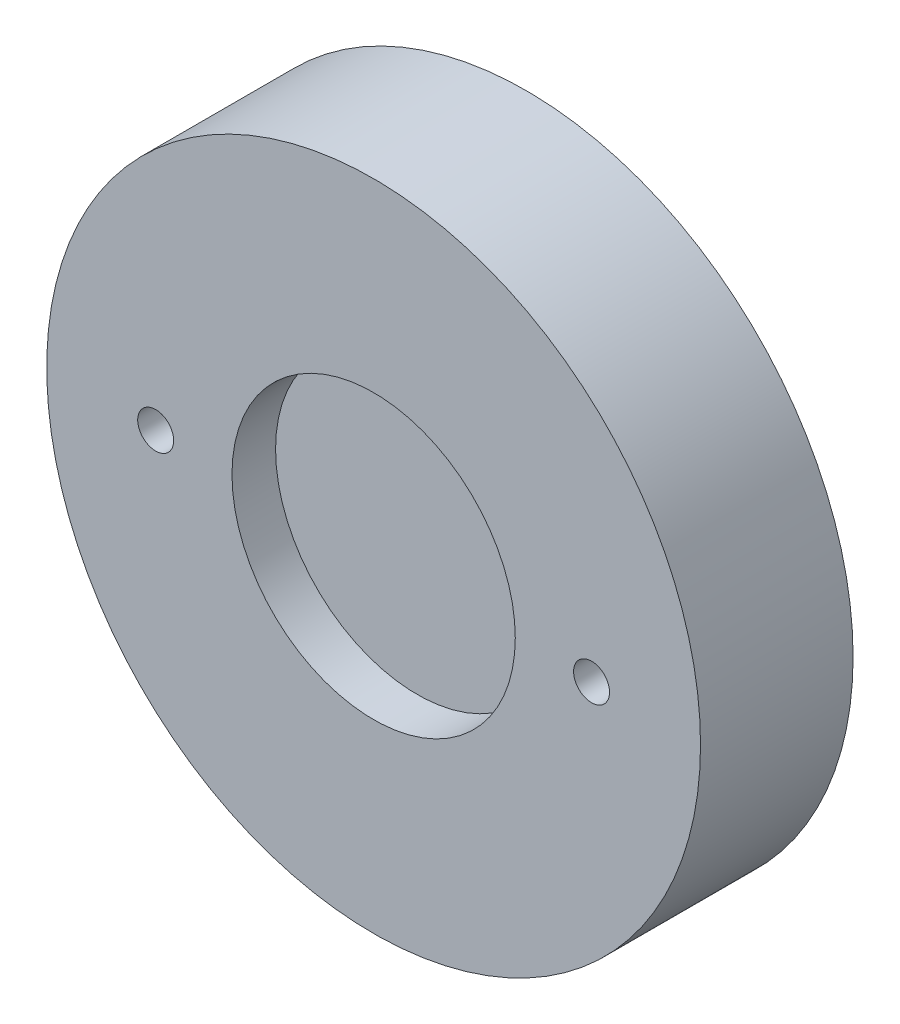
SolidWorks part; units mm, degrees
ref_plane "Plan de face" through (0, 0, 0) normal (0, 0, 1) x (1, 0, 0)
ref_plane "Plan de dessus" through (0, 0, 0) normal (0, 1, 0) x (1, 0, 0)
ref_plane "Plan de droite" through (0, 0, 0) normal (1, 0, 0) x (0, 0, -1)
sketch "Esquisse1" plane through (0, 0, 0) normal (0, 0, 1) x (1, 0, 0)
  circle A0 centre (0, 0) radius 60
extrude "Boss.-Extru.1" add sketch "Esquisse1" along normal blind 28
sketch "Esquisse2" plane through (0, 0, 28) normal (0, 0, 1) x (1, 0, 0)
  circle A0 centre (0, 0) radius 26
extrude "Enlèv. mat.-Extru.1" cut sketch "Esquisse2" against normal blind 8
sketch "Esquisse22" [suppressed] plane through (0, 0, 30) normal (0, 0, 1) x (1, 0, 0)
  line L0 (60, 0) -> (-60, 0) construction
  circle A0 centre (0, 0) radius 60 construction
  point P3 (40, 0)
  point P6 (-40, 0)
  dimension "D1" = 40
  dimension "D2" = 80
hole_wizard "Dégagement M62" positions "Esquisse26" profile "Esquisse25" hole size "M6" standard "ISO"
sketch "Esquisse26" plane through (0, 0, 28) normal (0, 0, 1) x (1, 0, 0)
  point P0 (-40, 0)
  point P1 (40, 0)
sketch "Esquisse25" plane through (-40, 0, 28) normal (1, 0, 0) x (0, -1, 0)
  line L0 (0, 0) -> (0, 28)
  line L1 (0, 28) -> (3.3, 28)
  line L2 (3.3, 28) -> (3.3, 0)
  line L5 (3.3, 0) -> (0, 0)
  line L11 (0, -6.35) -> (0, 107.95) construction
  dimension "Diamètre du perçage jusqu'au prochain" = 6.6
  dimension "Profondeur du perçage jusqu'au prochain" = 28
sketch "Esquisse27" plane through (0, 0, 20) normal (0, 0, 1) x (1, 0, 0)
  line L0 (0, 0) -> (34.8109, 0) construction
  point P3 (19.5, 0)
  dimension "D1" = 19.5
hole_wizard "Diamètre du perçage Ø4.0 (4)2" positions "Esquisse31" profile "Esquisse30" hole size "Ø4.0" standard "ISO"
sketch "Esquisse31" plane through (0, 0, 20) normal (0, 0, 1) x (1, 0, 0)
  point P0 (19.5, 0)
sketch "Esquisse30" plane through (19.5, 0, 20) normal (1, 0, 0) x (0, -1, 0)
  line L0 (0, 0) -> (0, 11.2017)
  line L1 (0, 11.2017) -> (2, 10)
  line L2 (2, 10) -> (2, 0)
  line L5 (2, 0) -> (0, 0)
  line L10 (0, 11.2017) -> (-2, 10) construction
  line L11 (0, -6.35) -> (0, 107.95) construction
  dimension "Diamètre du perçage" = 4
  dimension "Profondeur du perçage" = 10
  dimension "Angle de pointe" = 118
sketch "Esquisse4" [suppressed] plane through (0, 0, 0) normal (0, 0, -1) x (-1, 0, 0)
  line L0 (0, 60) -> (0, -60) construction
  line L1 (60, 0) -> (-60, 0) construction
  line L2 (0, 0) -> (-15.4704, 11.8708) construction
  line L3 (0, 0) -> (11.8708, 15.4704) construction
  line L4 (0, 0) -> (-11.8708, -15.4704) construction
  line L5 (0, 0) -> (15.4704, -11.8708) construction
  circle A0 centre (0, 0) radius 19.5 construction
  circle A1 centre (0, 0) radius 60 construction
  point P10 (-19.5, 0)
  dimension "D1" = 52.5
  dimension "D2" = 90
  dimension "D3" = 90
  dimension "D4" = 90
sketch "Esquisse9" plane through (0, 0, 0) normal (0, 0, -1) x (-1, 0, 0)
  circle A0 centre (0, 0) radius 12.5
extrude "Enlèv. mat.-Extru.4" [suppressed] cut sketch "Esquisse9" against normal through all
hole_wizard "Diamètre du perçage Ø5.3 (5.3)1" positions "Esquisse6" profile "Esquisse5" hole size "Ø5.3" standard "ISO"
sketch "Esquisse6" [suppressed] plane through (0, 0, 0) normal (0, 0, -1) x (-1, 0, 0)
  point P0 (-15.4704, 11.8708)
  point P1 (-11.8708, -15.4704)
  point P4 (15.4704, -11.8708)
  point P7 (11.8708, 15.4704)
sketch "Esquisse5" plane through (15.4704, 11.8708, 0) normal (1, 0, 0) x (0, 1, 0)
  line L0 (0, 0) -> (0, 27)
  line L1 (0, 27) -> (2.65, 27)
  line L2 (2.65, 27) -> (2.65, 0)
  line L5 (2.65, 0) -> (0, 0)
  line L11 (0, -6.35) -> (0, 107.95) construction
  dimension "Diamètre du perçage jusqu'au prochain" = 5.3
  dimension "Profondeur du perçage jusqu'au prochain" = 27
sketch "Esquisse7" [suppressed] plane through (0, 0, 0) normal (0, 0, -1) x (-1, 0, 0)
  circle A0 centre (-15.4704, 11.8708) radius 5
  circle A1 centre (11.8708, 15.4704) radius 5
  circle A2 centre (-11.8708, -15.4704) radius 5
  circle A3 centre (15.4704, -11.8708) radius 5
extrude "Enlèv. mat.-Extru.3" [suppressed] cut sketch "Esquisse7" against normal blind 6.5
sketch "Esquisse11" plane through (0, 0, 0) normal (0, 0, -1) x (-1, 0, 0)
  circle A0 centre (0, 0) radius 60
extrude "Enlèv. mat.-Extru.6" [suppressed] cut sketch "Esquisse11" against normal blind 1.5
sketch "Esquisse12" [suppressed] plane through (0, 0, 1.5) normal (0, 0, -1) x (-1, 0, 0)
  line L0 (-10, 28.0746) -> (-10, 55)
  line L1 (-10, 55) -> (10, 55)
  line L2 (10, 55) -> (10, 28.0746)
  line L3 (-10, -28.0746) -> (-10, -55)
  line L4 (-10, -55) -> (10, -55)
  line L5 (10, -55) -> (10, -28.0746)
  line L6 (60, 0) -> (-60, 0) construction
  line L7 (0, 60) -> (0, -60) construction
  arc A0 (-10, 28.0746) -> (-10, -28.0746) centre (0, 0) ccw
  arc A1 (10, -28.0746) -> (10, 28.0746) centre (0, 0) ccw
  dimension "D1" = 110
  dimension "D2" = 55
  dimension "D3" = 10
  dimension "D4" = 20
  dimension "D5" = 20
extrude "Enlèv. mat.-Extru.7" [suppressed] cut sketch "Esquisse12" against normal through all flip side to cut
fillet "Congé2" [suppressed] radius 6
chamfer "Chanfrein2" [suppressed] distance 15 angle 45
chamfer "Chanfrein3" [suppressed] distance 15 angle 45
sketch "Esquisse14" [suppressed] plane through (0, 19.25, -19.25) normal (0, 0.7071, -0.7071) x (1, 0, 0)
  line L0 (-10, -50.5581) -> (-10, -29.3449) construction
  line L1 (7.5, -57.3449) -> (-7.5, -57.3449)
  line L2 (7.5, -57.3449) -> (7.5, -22.3449)
  line L3 (7.5, -22.3449) -> (-7.5, -22.3449)
  line L4 (-7.5, -57.3449) -> (-7.5, -22.3449)
  line L5 (-10, -29.3449) -> (10, -29.3449) construction
  dimension "D1" = 15
  dimension "D2" = 2.5
  dimension "D3" = 35
  dimension "D4" = 7
extrude "Enlèv. mat.-Extru.9" [suppressed] cut sketch "Esquisse14" against normal blind 3
sketch "Esquisse15" [suppressed] plane through (0, -19.25, -19.25) normal (0, -0.7071, -0.7071) x (1, 0, 0)
  line L0 (10, 29.3449) -> (-10, 29.3449) construction
  line L1 (-7.5, 57.3449) -> (7.5, 57.3449)
  line L2 (-7.5, 57.3449) -> (-7.5, 22.3449)
  line L3 (-7.5, 22.3449) -> (7.5, 22.3449)
  line L4 (7.5, 57.3449) -> (7.5, 22.3449)
  line L5 (10, 50.5581) -> (10, 29.3449) construction
  dimension "D1" = 15
  dimension "D2" = 35
  dimension "D3" = 7
  dimension "D4" = 2.5
extrude "Enlèv. mat.-Extru.10" [suppressed] cut sketch "Esquisse15" against normal blind 3
chamfer "Chanfrein4" [suppressed] distance 15 angle 45
chamfer "Chanfrein5" [suppressed] distance 15 angle 45
hole_wizard "Trou taraudé M101" positions "Esquisse17" profile "Esquisse16" tap size "M10" standard "ISO"
sketch "Esquisse17" [suppressed] plane through (0, -17.1287, -17.1287) normal (0, -0.7071, -0.7071) x (1, 0, 0)
  line L0 (-7.5, 47.3762) -> (-7.5, 26.3449) construction
  line L1 (7.5, 47.3762) -> (-7.5, 47.3762) construction
  point P0 (0, 36.8762)
  dimension "D1" = 7.5
  dimension "D2" = 10.5
sketch "Esquisse16" plane through (0, -43.2041, 8.9467) normal (1, 0, 0) x (0, 0.7071, -0.7071)
  line L0 (0, 0) -> (0, 20.0537)
  line L1 (0, 20.0537) -> (4.25, 17.5)
  line L2 (4.25, 17.5) -> (4.25, 0)
  line L5 (4.25, 0) -> (0, 0)
  line L10 (0, 20.0537) -> (-4.25, 17.5) construction
  line L11 (0, -6.35) -> (0, 107.95) construction
  dimension "Diamètre du trou pour taraudage" = 8.5
  dimension "Profondeur du trou pour taraudage" = 17.5
  dimension "Angle de pointe" = 118
hole_wizard "Trou taraudé M102" positions "Esquisse19" profile "Esquisse18" tap size "M10" standard "ISO"
sketch "Esquisse19" [suppressed] plane through (0, 17.1287, -17.1287) normal (0, 0.7071, -0.7071) x (-1, 0, 0)
  line L0 (7.5, 47.3762) -> (-7.5, 47.3762) construction
  line L1 (7.5, 26.3449) -> (7.5, 47.3762) construction
  point P0 (0, 36.8762)
  dimension "D1" = 10.5
  dimension "D2" = 7.5
sketch "Esquisse18" [suppressed] plane through (0, 43.2041, 8.9467) normal (1, 0, 0) x (0, 0.7071, 0.7071)
  line L0 (0, 0) -> (0, 20.0537)
  line L1 (0, 20.0537) -> (4.25, 17.5)
  line L2 (4.25, 17.5) -> (4.25, 0)
  line L5 (4.25, 0) -> (0, 0)
  line L10 (0, 20.0537) -> (-4.25, 17.5) construction
  line L11 (0, -6.35) -> (0, 107.95) construction
  dimension "Diamètre du trou pour taraudage" = 8.5
  dimension "Profondeur du trou pour taraudage" = 17.5
  dimension "Angle de pointe" = 118
chamfer "Chanfrein6" distance 0.5 angle 45 1 edges at (21.5, 0, 20)
